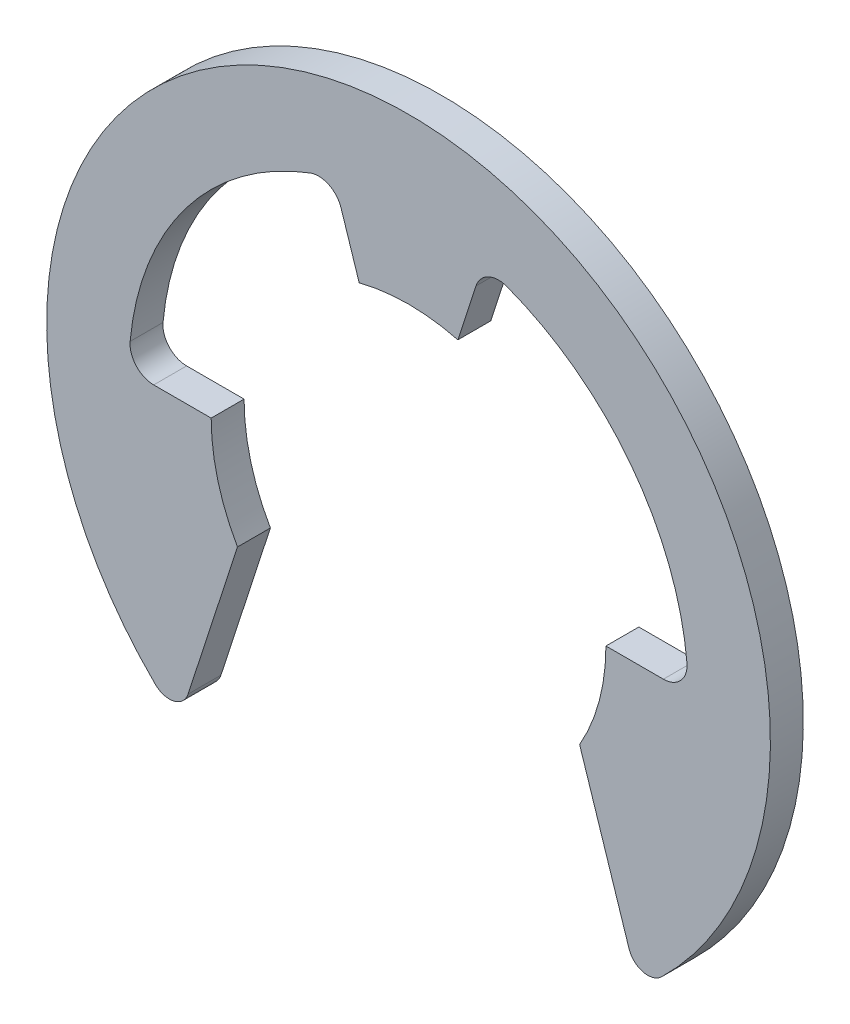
SolidWorks part; units mm, degrees
ref_plane "Front Plane" through (0, 0, 0) normal (0, 0, 1) x (1, 0, 0)
ref_plane "Top Plane" through (0, 0, 0) normal (0, 1, 0) x (1, 0, 0)
ref_plane "Right Plane" through (0, 0, 0) normal (1, 0, 0) x (0, 0, -1)
sketch "BodySke" plane through (0, 0, 0) normal (0, 0, 1) x (1, 0, 0)
  line L0 (-34.7902, 0) -> (37.4871, 0) construction
  line L1 (0, -29.1266) -> (0, 42.3415) construction
  line L2 (10.4, -5.9867) -> (13.4058, -15.2376)
  line L3 (-10.4, -5.9867) -> (-13.4058, -15.2376)
  line L4 (12, 0) -> (17, 0)
  line L5 (-12, 0) -> (-17, 0)
  line L6 (-3, 11.619) -> (-4.5471, 16.3806)
  line L7 (3, 11.619) -> (4.5471, 16.3806)
  arc A0 (15.3863, -15.7245) -> (-15.3863, -15.7245) centre (0, 0) ccw
  arc A1 (-12, 0) -> (-10.4, -5.9867) centre (0, 0) ccw
  arc A2 (-4.5471, 16.3806) -> (-17, 0) centre (0, 0) ccw
  arc A3 (3, 11.619) -> (-3, 11.619) centre (0, 0) ccw
  circle A4 centre (0, 0) radius 17 construction
  circle A5 centre (0, 0) radius 22 construction
  arc A6 (10.4, -5.9867) -> (12, 0) centre (0, 0) ccw
  arc A7 (17, 0) -> (4.5471, 16.3806) centre (0, 0) ccw
  arc A8 (-13.4058, -15.2376) -> (-15.3863, -15.7245) centre (-14.5471, -14.8668) cw
  arc A9 (15.3863, -15.7245) -> (13.4058, -15.2376) centre (14.5471, -14.8668) cw
  point P23 (-13.9755, -16.9908)
  point P26 (13.9755, -16.9908)
  point P29 (-17, 0)
  point P32 (17, 0)
  point P35 (4.5471, 16.3806)
  point P38 (-4.5471, 16.3806)
  dimension "Outside_Diameter" = 44
  dimension "Inside_Diameter" = 24
  dimension "D8" = 1.2
  dimension "Width" = 20.8
  dimension "Groove_ang" = 18
  dimension "D7" = 6
  dimension "Angle" = 36
  dimension "Groove_Width" = 5
extrude "BaseBody" add sketch "BodySke" along normal blind 2
fillet "Fillet1" radius 1.44 4 edges at (17, 0, 1) (4.5471, 16.3806, 1) (-4.5471, 16.3806, 1) (-17, 0, 1)
equation "\"D7@BodySke\" = \"Inside_Diameter@BodySke\" / 4"
equation "\"D8@BodySke\" = \"Inside_Diameter@BodySke\" * 0.05"
equation "\"Fillet_radius@Fillet1\" = \"Inside_Diameter@BodySke\" * 0.06"
